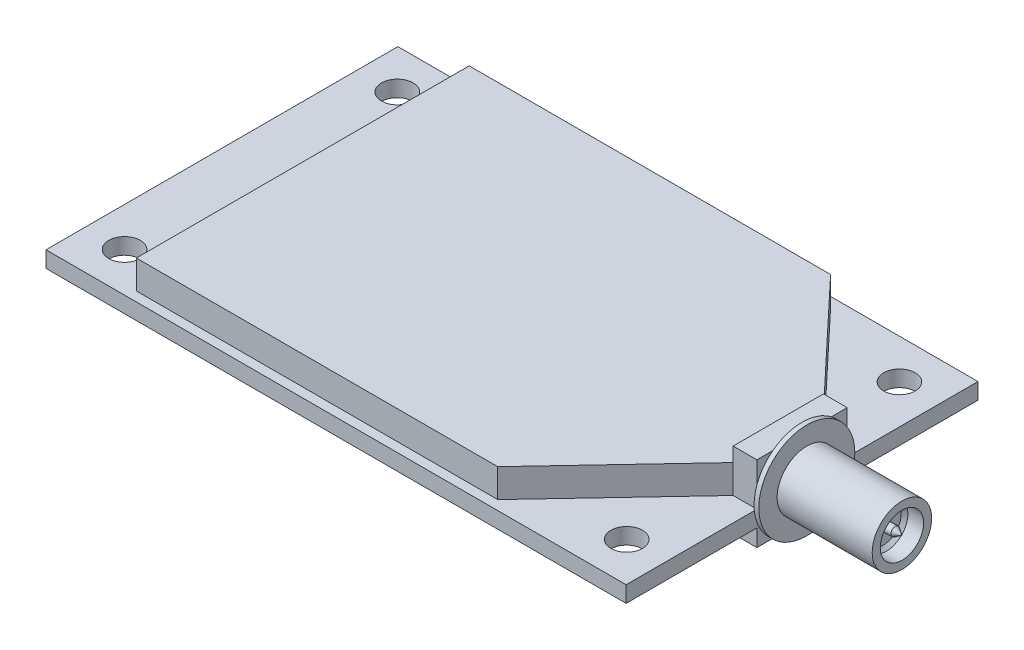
SolidWorks part; units mm, degrees
ref_plane "Alzado" through (0, 0, 0) normal (0, 0, 1) x (1, 0, 0)
ref_plane "Planta" through (0, 0, 0) normal (0, 1, 0) x (1, 0, 0)
ref_plane "Vista lateral" through (0, 0, 0) normal (1, 0, 0) x (0, 0, -1)
imported_body "Part2^xBee XTend Radio-1-surface1"
scale "Escala1" bodies to scale 101 scale about centroid uniform scaling yes scale factor 0.65
